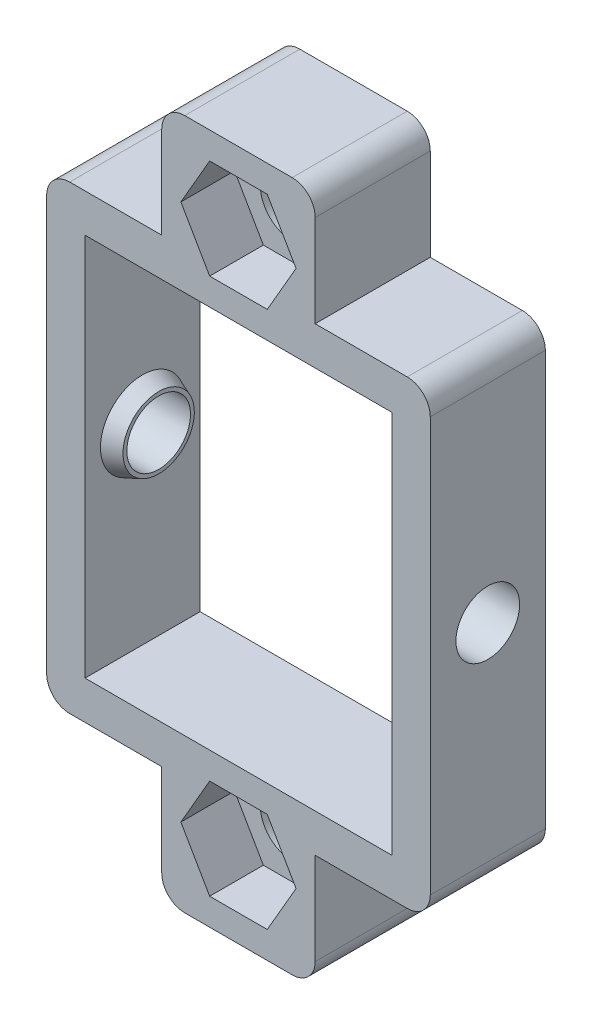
SolidWorks part; units mm, degrees
ref_plane "Plan de face" through (0, 0, 0) normal (0, 0, 1) x (1, 0, 0)
ref_plane "Plan de dessus" through (0, 0, 0) normal (0, 1, 0) x (1, 0, 0)
ref_plane "Plan de droite" through (0, 0, 0) normal (1, 0, 0) x (0, 0, -1)
sketch "Esquisse1" plane through (0, 0, 0) normal (0, 0, 1) x (1, 0, 0)
  line L0 (-5, 5) -> (-5, -55)
  line L1 (0, 0) -> (40, 0)
  line L2 (0, 0) -> (0, -50)
  line L3 (0, -50) -> (40, -50)
  line L4 (40, 0) -> (40, -50)
  line L5 (-5, -55) -> (10, -55)
  line L6 (45, 5) -> (45, -55)
  line L7 (-5, 5) -> (10, 5)
  line L8 (30, 5) -> (45, 5)
  line L10 (10, 5) -> (10, 20)
  line L11 (10, 20) -> (30, 20)
  line L12 (30, 5) -> (30, 20)
  line L14 (10, -55) -> (10, -70)
  line L15 (10, -70) -> (30, -70)
  line L16 (30, -55) -> (30, -70)
  line L17 (30, -55) -> (45, -55)
  line L18 (-5, 5) -> (45, 5) construction
  line L20 (-5, -55) -> (45, -55) construction
  dimension "D1" = 40
  dimension "D2" = 50
  dimension "D4" = 15
  dimension "D5" = 20
  dimension "D6" = 20
  dimension "D7" = 15
  dimension "D8" = 10
  dimension "D3" = 5
extrude "Boss.-Extru.1" add sketch "Esquisse1" along normal blind 15
sketch "Esquisse2" plane through (0, 0, 15) normal (0, 0, 1) x (1, 0, 0)
  line L1 (30, 20) -> (10, 20) construction
  line L2 (10, -70) -> (30, -70) construction
  line L3 (10, -55) -> (10, -70) construction
  line L4 (10, 20) -> (10, 5) construction
  circle A0 centre (20, 10) radius 4.15
  circle A1 centre (20, -60) radius 4.15
  dimension "D1" = 8.3
  dimension "D4" = 10
  dimension "D5" = 10
  dimension "D2" = 10
  dimension "D3" = 10
extrude "Enlèv. mat.-Extru.1" cut sketch "Esquisse2" against normal through all
sketch "Esquisse3" plane through (0, 0, 15) normal (0, 0, 1) x (1, 0, 0)
  line L0 (30, 20) -> (10, 20) construction
  line L1 (16.2472, 16.5) -> (12.4944, 10)
  line L2 (12.4944, 10) -> (16.2472, 3.5)
  line L3 (16.2472, 3.5) -> (23.7528, 3.5)
  line L4 (23.7528, 3.5) -> (27.5056, 10)
  line L5 (27.5056, 10) -> (23.7528, 16.5)
  line L6 (23.7528, 16.5) -> (16.2472, 16.5)
  line L7 (12.4944, -60) -> (16.2472, -66.5)
  line L8 (16.2472, -66.5) -> (23.7528, -66.5)
  line L9 (23.7528, -66.5) -> (27.5056, -60)
  line L10 (27.5056, -60) -> (23.7528, -53.5)
  line L11 (23.7528, -53.5) -> (16.2472, -53.5)
  line L12 (16.2472, -53.5) -> (12.4944, -60)
  circle A0 centre (20, 10) radius 6.5 construction
  circle A1 centre (20, -60) radius 6.5 construction
  dimension "D1" = 13
  dimension "D2" = 13
extrude "Enlèv. mat.-Extru.2" cut sketch "Esquisse3" against normal blind 7
sketch "Esquisse4" plane through (-5, 0, 0) normal (-1, 0, 0) x (0, 0, 1)
  line L0 (15, 5) -> (15, -55) construction
  line L2 (15, 5) -> (0, 5) construction
  circle A0 centre (7.5, -25) radius 4.15
  dimension "D1" = 8.3
  dimension "D2" = 7.5
  dimension "D3" = 30
extrude "Enlèv. mat.-Extru.3" cut sketch "Esquisse4" against normal through all
sketch "Esquisse5" plane through (45, 0, 0) normal (1, 0, 0) x (0, 0, -1)
  line L0 (-15, -55) -> (-15, 5) construction
  line L1 (-1, -21.2472) -> (-7.5, -17.4944)
  line L2 (-7.5, -17.4944) -> (-14, -21.2472)
  line L3 (-14, -21.2472) -> (-14, -28.7528)
  line L4 (-14, -28.7528) -> (-7.5, -32.5056)
  line L5 (-7.5, -32.5056) -> (-1, -28.7528)
  line L6 (-1, -28.7528) -> (-1, -21.2472)
  circle A0 centre (-7.5, -25) radius 6.5 construction
  dimension "D1" = 13
fillet "Congé1" radius 3 8 edges at (30, -70, 7.5) (45, -55, 7.5) (45, 5, 7.5) (30, 20, 7.5) (10, 20, 7.5) (-5, 5, 7.5) (-5, -55, 7.5) (10, -70, 7.5)
sketch "Esquisse6" plane through (0, 0, 0) normal (1, 0, 0) x (0, 0, -1)
  circle A1 centre (-7.5, -25) radius 4.15
  circle A2 centre (-7.5, -25) radius 5.65
  dimension "D1" = 8.3
  dimension "D2" = 1.5
extrude "Boss.-Extru.2" add sketch "Esquisse6" along normal blind 2.1
sketch "Esquisse7" plane through (40, 0, 0) normal (-1, 0, 0) x (0, 0, 1)
  circle A0 centre (7.5, -25) radius 4.15
  circle A1 centre (7.5, -25) radius 5.65
  dimension "D1" = 8.3
  dimension "D2" = 1.5
extrude "Boss.-Extru.3" add sketch "Esquisse7" along normal blind 2.1
chamfer "Chanfrein1" distance 2.5 distance2 1 2 edges at (2.1, -19.35, 7.5) (37.9, -30.65, 7.5)
